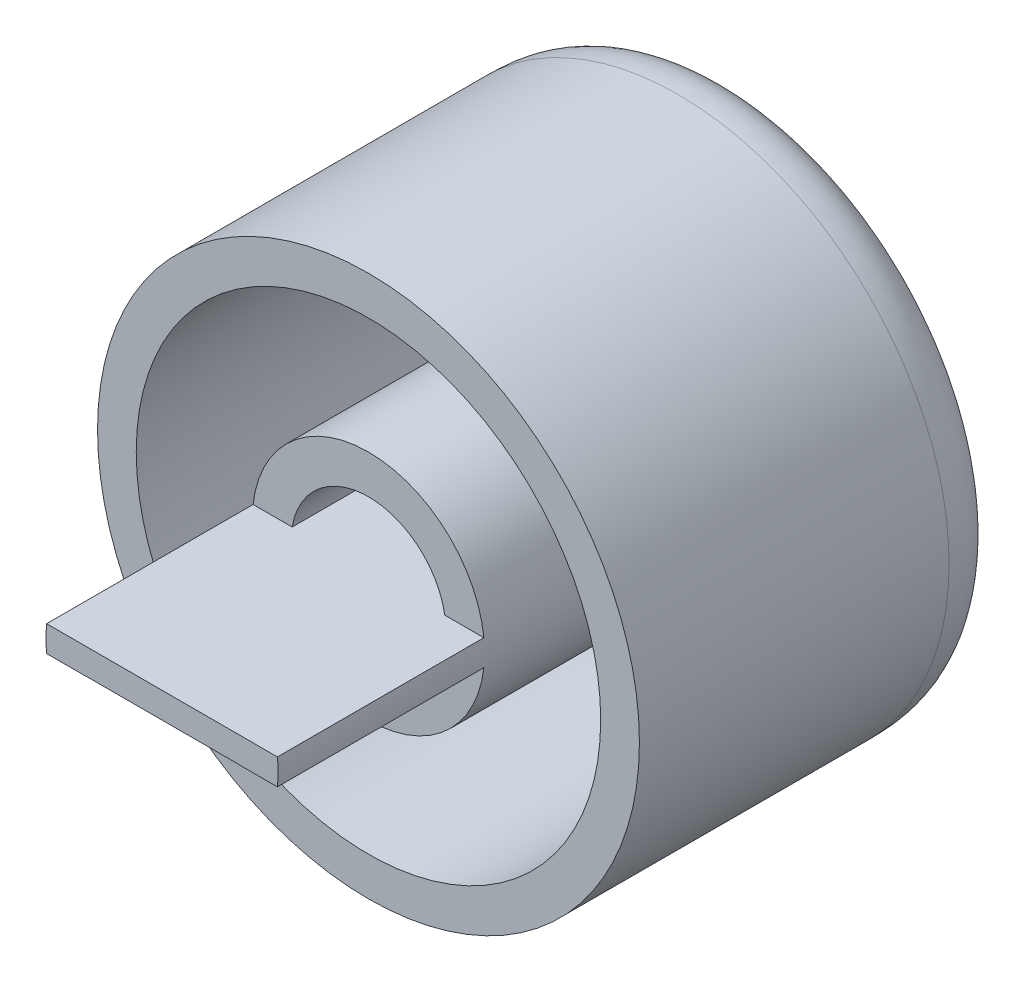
SolidWorks part; units mm, degrees
ref_plane "Plan de face" through (0, 0, 0) normal (0, 0, 1) x (1, 0, 0)
ref_plane "Plan de dessus" through (0, 0, 0) normal (0, 1, 0) x (1, 0, 0)
ref_plane "Plan de droite" through (0, 0, 0) normal (1, 0, 0) x (0, 0, -1)
sketch "Esquisse1" plane through (0, 0, 0) normal (0, 0, 1) x (1, 0, 0)
  circle A0 centre (0, 0) radius 10.5
extrude "Boss.-Extru.1" add sketch "Esquisse1" along normal blind 2
sketch "Esquisse2" plane through (0, 0, 2) normal (0, 0, 1) x (1, 0, 0)
  line L0 (2.9576, 0.5026) -> (-2.9576, 0.5026)
  line L8 (-2.9585, -0.4974) -> (2.9585, -0.4974)
  circle A0 centre (0, 0) radius 10.5
  circle A1 centre (0, 0) radius 9
  circle A2 centre (0, 0) radius 4.5
  circle A3 centre (0, 0) radius 3
  point P6 (0, 0)
  point P13 (-3, 0.5026)
  point P16 (0, 0)
extrude "Boss.-Extru.6" add sketch "Esquisse2" along normal blind 12 contours A1 M1 | A2 A3 | L0 A3 L8
sketch "Esquisse3" plane through (0, 0, 14) normal (0, 0, 1) x (1, 0, 0)
  line L0 (2.9576, 0.5026) -> (4.4718, 0.5026)
  line L1 (4.4718, 0.5026) -> (-4.4718, 0.5026)
  line L2 (4.4718, -0.5026) -> (-4.4718, -0.5026)
  circle A0 centre (0, 0) radius 4.5 construction
  circle A1 centre (0, 0) radius 4.5
extrude "Boss.-Extru.7" add sketch "Esquisse3" along normal blind 8 contours L2 L0 L1 M6 M3 M4 M5
fillet "Congé2" radius 2 1 edges at (10.5, 0, 0)
sketch "Esquisse4" plane through (0, 0, 0) normal (0, 0, -1) x (-1, 0, 0)
  circle A0 centre (0, -7.1119) radius 1
extrude "Enlèv. mat.-Extru.1" cut sketch "Esquisse4" against normal blind 1
fillet "Congé4" radius 0.5 1 edges at (-1, -7.1119, 0)
